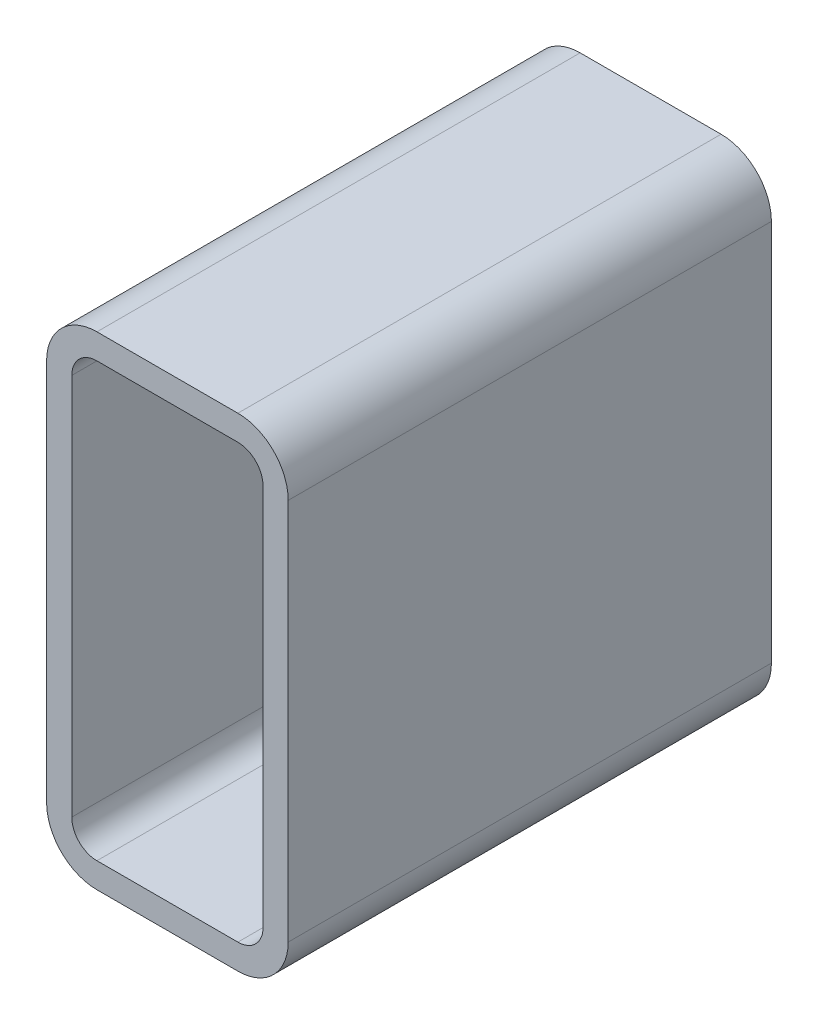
SolidWorks part; units mm, degrees
ref_plane "Front Plane" through (0, 0, 0) normal (0, 0, 1) x (1, 0, 0)
ref_plane "Top Plane" through (0, 0, 0) normal (0, 1, 0) x (1, 0, 0)
ref_plane "Right Plane" through (0, 0, 0) normal (1, 0, 0) x (0, 0, -1)
sketch "Sketch1" plane through (0, 0, 0) normal (0, 0, 1) x (1, 0, 0)
sketch_block_instance "HSS12x6x0.625-1"
sketch_block "HSS12x6x0.625"
extrude "Boss-Extrude1" add sketch "Sketch1" along normal blind 304.8
